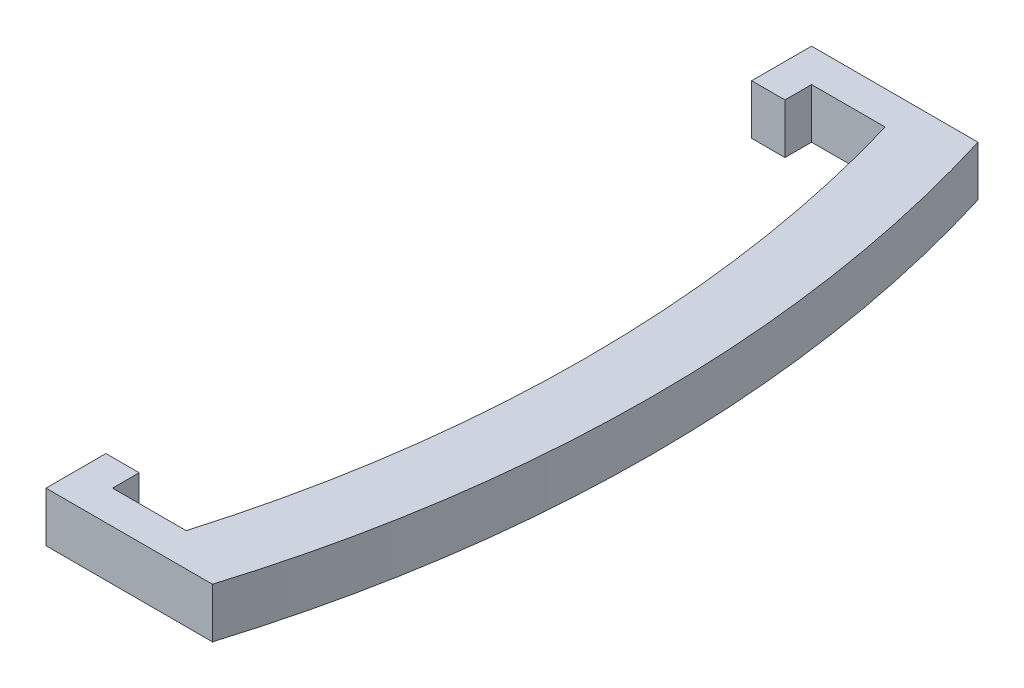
SolidWorks part; units mm, degrees
ref_plane "Plan de face" through (0, 0, 0) normal (0, 0, 1) x (1, 0, 0)
ref_plane "Plan de dessus" through (0, 0, 0) normal (0, 1, 0) x (1, 0, 0)
ref_plane "Plan de droite" through (0, 0, 0) normal (1, 0, 0) x (0, 0, -1)
sketch "Esquisse1" plane through (0, 0, 0) normal (1, 0, 0) x (0, 0, -1)
  line L0 (2.4, 0) -> (2.4, 8) construction
  line L1 (0, 0) -> (40.8, 0)
  line L3 (2.4, 8) -> (38.4, 8)
  line L5 (20.4, 0) -> (20.4, 8) construction
  arc A0 (0, 0) -> (2.4, 8) centre (14.5333, 0) cw
  arc A1 (2.4, 8) -> (0, 0) centre (14.5333, 0) ccw
  arc A2 (40.8, 0) -> (38.4, 8) centre (26.2667, 0) ccw
  dimension "D4" = 14.5333
  dimension "D1" = 36
  dimension "D2" = 40.8
  dimension "D3" = 8
  dimension "D5" = 2.4
ref_plane "Plan1" through (0, 0, -20.4) normal (0, 0, 1) x (1, 0, 0)
sketch "Esquisse7" plane through (0, 0, 0) normal (0, 1, 0) x (1, 0, 0)
  line L0 (80.9953, 0) -> (0, 0) construction
  line L1 (0, 0) -> (0, 40.8) construction
  line L2 (79.9957, 31.9) -> (79.9957, 30.1)
  line L3 (79.8523, 2) -> (2, 2) construction
  line L4 (2, 20.4) -> (86.72, 20.4) construction
  line L5 (2, 2) -> (2, 20.4) construction
  line L6 (2, 38.8) -> (2, 20.4) construction
  line L7 (79.8523, 38.8) -> (2, 38.8) construction
  line L8 (84.9957, 31.9) -> (82.8983, 31.9) construction
  line L9 (80.9953, 40.8) -> (0, 40.8) construction
  line L10 (84.9957, 31.9) -> (79.9957, 31.9)
  line L11 (79.9957, 30.1) -> (80.9957, 30.1)
  line L12 (80.9957, 30.1) -> (80.9957, 30.9)
  line L13 (80.9957, 30.9) -> (83.2078, 30.9)
  line L14 (84.9957, 8.9) -> (82.8983, 8.9) construction
  line L15 (80.9957, 9.9) -> (83.2078, 9.9)
  line L16 (80.9957, 10.7) -> (80.9957, 9.9)
  line L17 (79.9957, 10.7) -> (80.9957, 10.7)
  line L18 (84.9957, 8.9) -> (79.9957, 8.9)
  line L19 (79.9957, 8.9) -> (79.9957, 10.7)
  arc A0 (80.9953, 0) -> (84.9957, 8.9) centre (47.51, 20.4) ccw construction
  arc A1 (79.8523, 2) -> (82.8983, 8.9) centre (47.51, 20.4) ccw construction
  arc A2 (84.9957, 31.9) -> (84.9957, 8.9) centre (47.51, 20.4) cw
  arc A3 (79.8523, 38.8) -> (82.8983, 31.9) centre (47.51, 20.4) cw construction
  arc A4 (80.9953, 40.8) -> (84.9957, 31.9) centre (47.51, 20.4) cw construction
  arc A5 (83.2078, 9.9) -> (83.2078, 30.9) centre (47.51, 20.4) ccw
  point P19 (0, 20.4)
  dimension "D3" = 11.5
  dimension "D4" = 39.21
  dimension "D1" = 20.4
  dimension "D2" = 80.9953
  dimension "D5" = 5
  dimension "D6" = 1.8
  dimension "D7" = 1
  dimension "D8" = 1
extrude "Extrusion2" add sketch "Esquisse7" against normal blind 1.5 separate body
